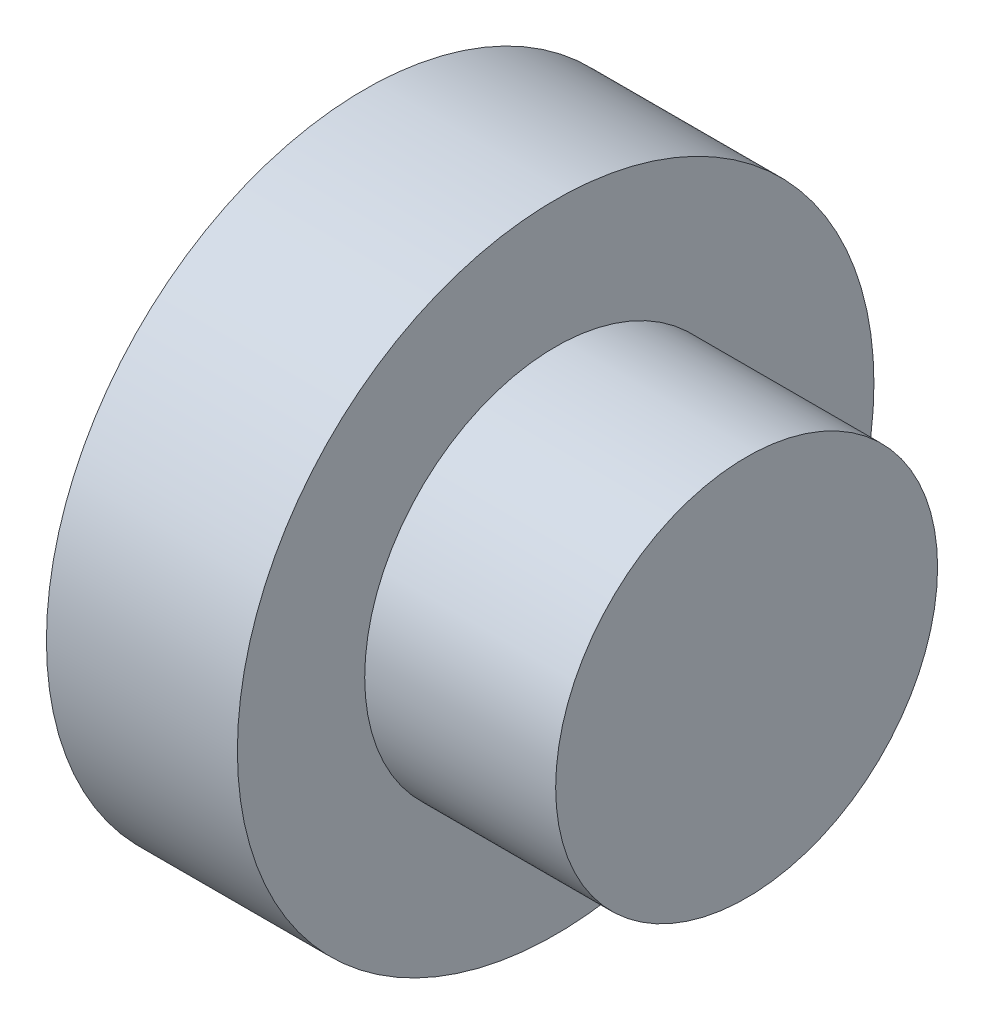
SolidWorks part; units mm, degrees
ref_plane "Front" through (0, 0, 0) normal (0, 0, 1) x (1, 0, 0)
ref_plane "Top" through (0, 0, 0) normal (0, 1, 0) x (1, 0, 0)
ref_plane "Right" through (0, 0, 0) normal (1, 0, 0) x (0, 0, -1)
sketch "Sketch1" plane through (0, 0, 0) normal (0, 1, 0) x (1, 0, 0)
  line L0 (0, 0) -> (6, 0)
  line L1 (6, 0) -> (6, 3)
  line L2 (6, 3) -> (3, 3)
  line L3 (3, 3) -> (3, 5)
  line L4 (3, 5) -> (0, 5)
  line L5 (0, 5) -> (0, 0)
revolve "Revolve1" add sketch "Sketch1" angle 360 about L0
